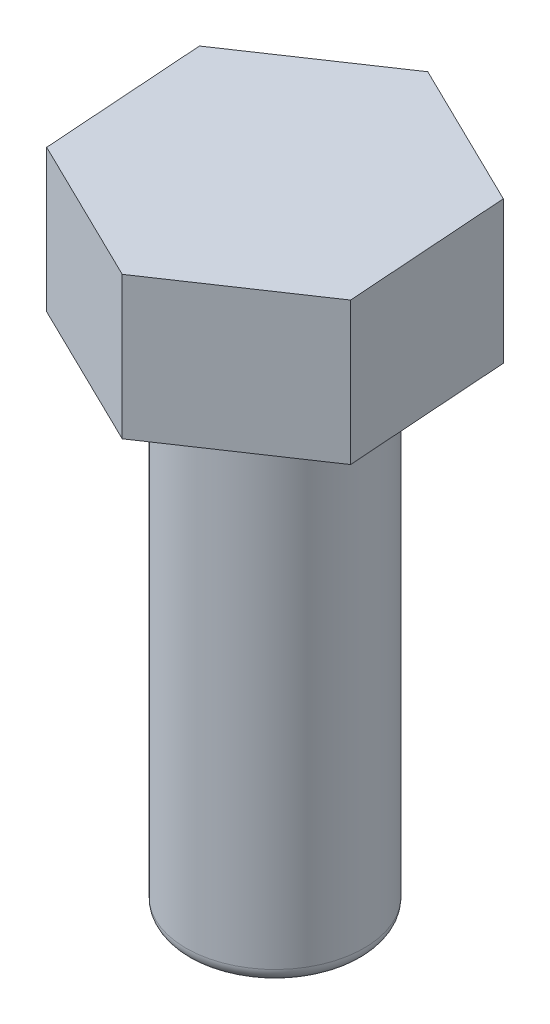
SolidWorks part; units mm, degrees
ref_plane "Front" through (0, 0, 0) normal (0, 0, 1) x (1, 0, 0)
ref_plane "Top" through (0, 0, 0) normal (0, 1, 0) x (1, 0, 0)
ref_plane "Right" through (0, 0, 0) normal (1, 0, 0) x (0, 0, -1)
sketch "Sketch2" plane through (0, 0, 0) normal (0, 1, 0) x (1, 0, 0)
  line L1 (207.4806, -101.4156) -> (191.5688, 128.9756)
  line L2 (191.5688, 128.9756) -> (-15.9118, 230.3913)
  line L3 (-15.9118, 230.3913) -> (-207.4806, 101.4156)
  line L4 (-207.4806, 101.4156) -> (-191.5688, -128.9756)
  line L5 (-191.5688, -128.9756) -> (15.9118, -230.3913)
  line L6 (15.9118, -230.3913) -> (207.4806, -101.4156)
  circle A0 centre (0, 0) radius 200 construction
  dimension "D1" = 400
extrude "Boss-Extrude1" add sketch "Sketch2" against normal blind 200
sketch "Sketch3" plane through (0, -200, 0) normal (0, 1, 0) x (1, 0, 0)
  circle A0 centre (0, 0) radius 125
  dimension "D1" = 250
extrude "Boss-Extrude2" add sketch "Sketch3" against normal blind 700
fillet "Fillet1" radius 20 1 edges at (0, -900, 125)
